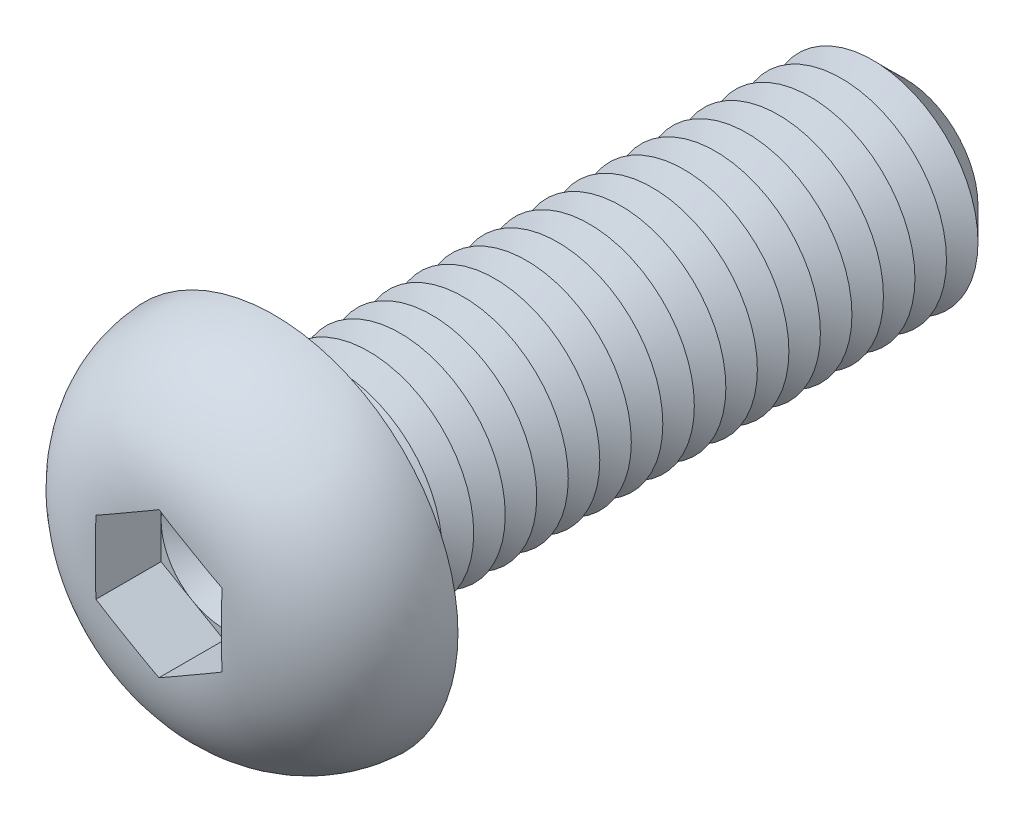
SolidWorks part; units mm, degrees
ref_plane "Front Plane" through (0, 0, 0) normal (0, 0, 1) x (1, 0, 0)
ref_plane "Top Plane" through (0, 0, 0) normal (0, 1, 0) x (1, 0, 0)
ref_plane "Right Plane" through (0, 0, 0) normal (1, 0, 0) x (0, 0, -1)
sketch "Sketch1" plane through (0, 0, 0) normal (1, 0, 0) x (0, 0, -1)
  line L0 (-47.9342, 0) -> (60.3146, 0) construction
sketch "Sketch2" plane through (0, 0, 0) normal (1, 0, 0) x (0, 0, -1)
  line L0 (0, 0) -> (-5.5, 0)
  line L1 (-47.9342, 0) -> (60.3146, 0) construction
  line L2 (-5.5, 0) -> (-5.5, 2.9578)
  line L3 (0, 8.75) -> (0, 0)
  arc A0 (-5.5, 2.9578) -> (0, 8.75) centre (0.3, 2.9578) cw
  dimension "D1" = 5.8
  dimension "D2" = 5.5
  dimension "D3" = 8.75
revolve "Revolve1" add sketch "Sketch2" angle 360 about L0
sketch "Sketch3" plane through (0, 0, 5.5) normal (0, 0, 1) x (1, 0, 0)
  line L1 (0, 3.4641) -> (-3, 1.7321)
  line L2 (-3, 1.7321) -> (-3, -1.7321)
  line L3 (-3, -1.7321) -> (0, -3.4641)
  line L4 (0, -3.4641) -> (3, -1.7321)
  line L5 (3, -1.7321) -> (3, 1.7321)
  line L6 (3, 1.7321) -> (0, 3.4641)
  circle A0 centre (0, 0) radius 3 construction
  dimension "D1" = 6
extrude "Cut-Extrude1" cut sketch "Sketch3" against normal blind 3.12
sketch "Sketch4" plane through (0, 0, 0) normal (0, 0, -1) x (-1, 0, 0)
  circle A0 centre (0, 0) radius 5
  dimension "D1" = 10
extrude "Boss-Extrude1" add sketch "Sketch4" along normal blind 30
chamfer "Chamfer1" distance 1.5 angle 45 1 edges at (-5, 0, -30)
sketch "Sketch5" plane through (0, 0, 0) normal (1, 0, 0) x (0, 0, -1)
  line L0 (1.5, 5) -> (3, 5)
  line L1 (28.5, 5) -> (0, 5) construction
  line L2 (3, 5) -> (2.25, 3.701)
  line L3 (2.25, 3.701) -> (1.5, 5)
  line L4 (0, -8.75) -> (0, 8.75) construction
  line L5 (28.5, 5) -> (0, 5) construction
  dimension "D1" = 1.5
  dimension "D2" = 1.5
revolve "Cut-Revolve1" cut sketch "Sketch5" angle 360 about L0
pattern_linear "LPattern1" count 18 spacing 1.5 along (0, 0, -1) of "Cut-Revolve1"
fillet "Fillet2" radius 0.6 1 edges at (5, 0, 0)
sketch "Sketch6" plane through (0, 0, 2.38) normal (0, 0, 1) x (1, 0, 0)
  line L0 (0, -3.4641) -> (3, -1.7321) construction
  circle A0 centre (0, 0) radius 3
extrude "Cut-Extrude2" cut sketch "Sketch6" against normal through all draft 60
